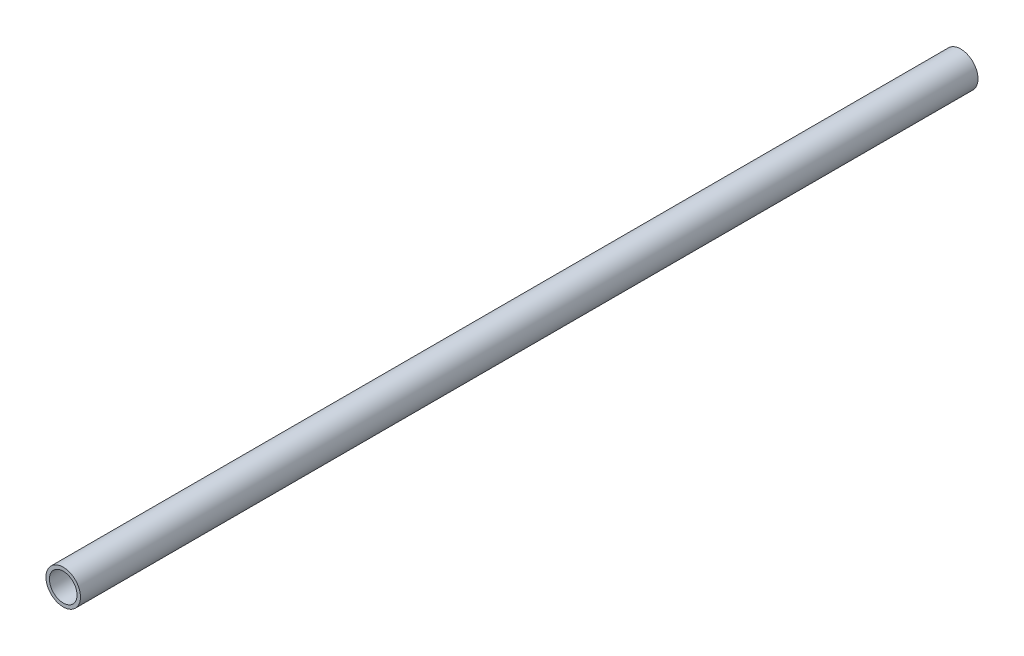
SolidWorks part; units mm, degrees
ref_plane "Front Plane" through (0, 0, 0) normal (0, 0, 1) x (1, 0, 0)
ref_plane "Top Plane" through (0, 0, 0) normal (0, 1, 0) x (1, 0, 0)
ref_plane "Right Plane" through (0, 0, 0) normal (1, 0, 0) x (0, 0, -1)
sketch "Sketch1" plane through (0, 0, 0) normal (0, 0, 1) x (1, 0, 0)
  circle A0 centre (0, 0) radius 25
  circle A1 centre (0, 0) radius 20
  dimension "D1" = 50
  dimension "D2" = 40
extrude "Boss-Extrude1" add sketch "Sketch1" along normal blind 1300
